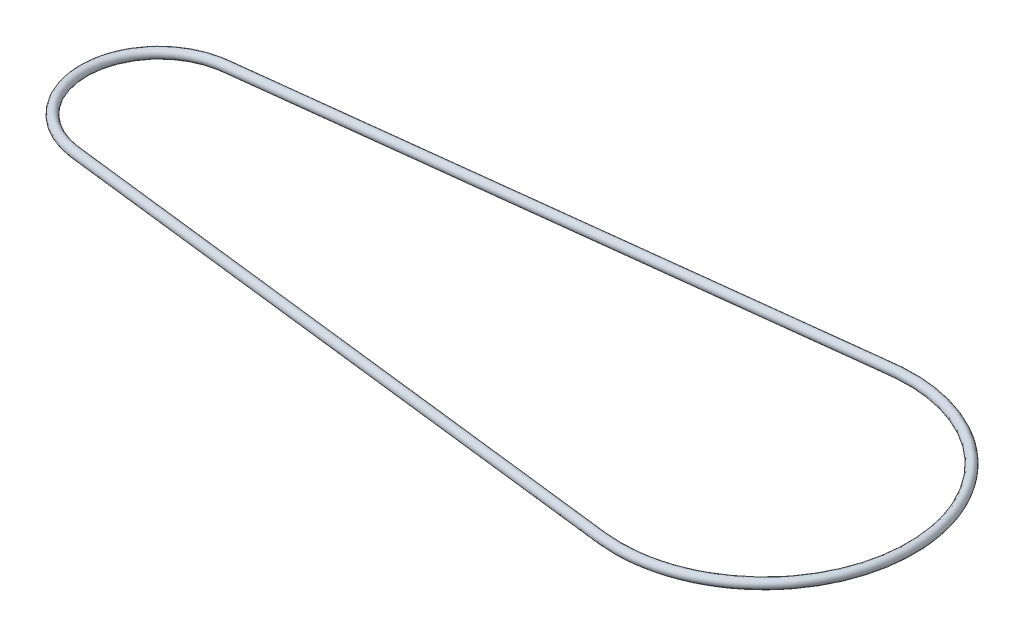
SolidWorks part; units mm, degrees
ref_plane "Front Plane" through (0, 0, 0) normal (0, 0, 1) x (1, 0, 0)
ref_plane "Top Plane" through (0, 0, 0) normal (0, 1, 0) x (1, 0, 0)
ref_plane "Right Plane" through (0, 0, 0) normal (1, 0, 0) x (0, 0, -1)
sketch "Sketch3" plane through (0, 0, 0) normal (1, 0, 0) x (0, 0, -1)
  circle A0 centre (-45.2097, 0) radius 1.524
  dimension "D1" = 3.048
sketch "Sketch4" plane through (0, 0, 0) normal (0, 1, 0) x (1, 0, 0)
  spline S0 degree 3 number of poles 68 (-7.6339, -44.746) -> (-7.6339, -44.746)
sweep "Sweep2" add profiles "Sketch3" path "Sketch4"
ref_plane "Plane1" through (0, 0, 0) normal (1, 0, 0) x (0, 0, -1)
ref_plane "Plane2" through (0, 0, -3.48) normal (0, 0, 1) x (1, 0, 0)
ref_plane "Plane3" through (0, 0, 0) normal (0, 1, 0) x (1, 0, 0)
ref_plane "Plane4" through (-203.2, 0, 0) normal (1, 0, 0) x (0, 0, -1)
